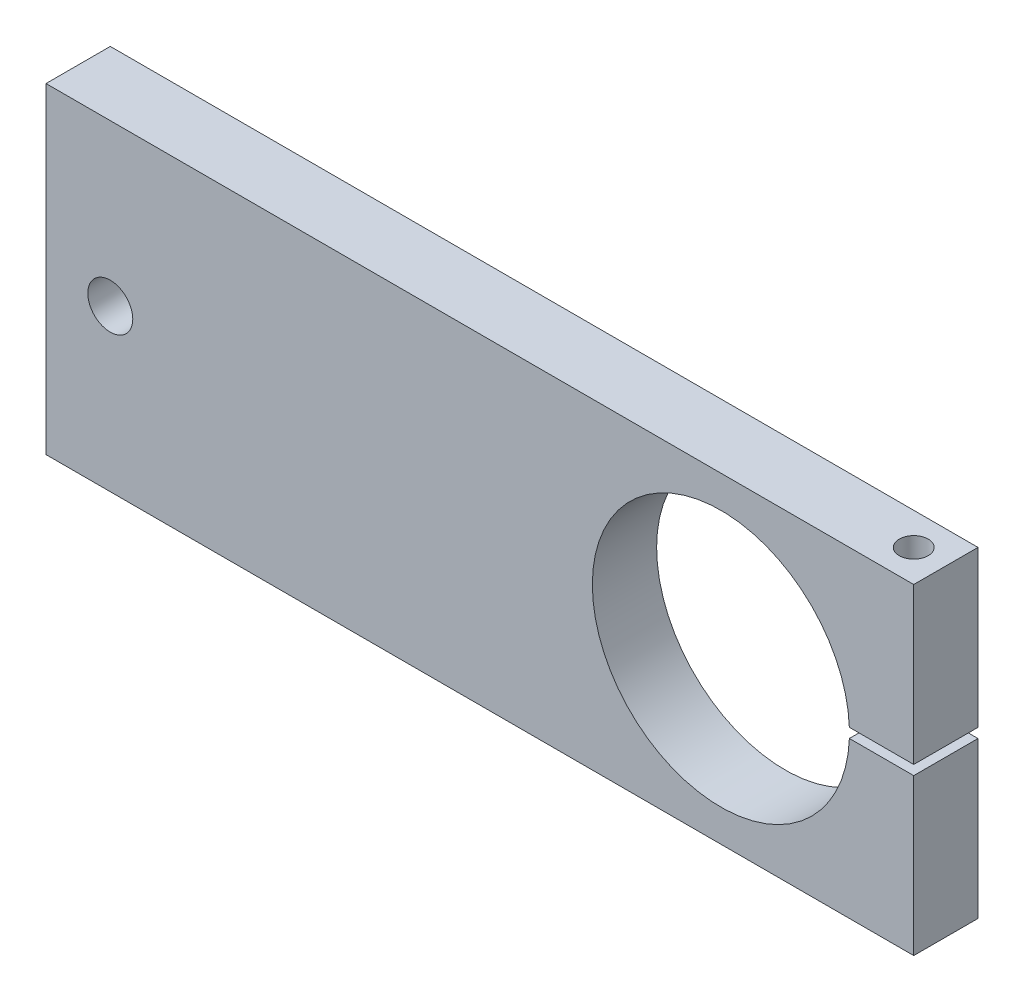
SolidWorks part; units mm, degrees
ref_plane "前视基准面" through (0, 0, 0) normal (0, 0, 1) x (1, 0, 0)
ref_plane "上视基准面" through (0, 0, 0) normal (0, 1, 0) x (1, 0, 0)
ref_plane "右视基准面" through (0, 0, 0) normal (1, 0, 0) x (0, 0, -1)
sketch "草图1" plane through (0, 0, 0) normal (0, 0, 1) x (1, 0, 0)
  line L0 (0, 0) -> (-190, 0) construction
  line L1 (-190, 0) -> (-210, 0) construction
  line L2 (-210, 50) -> (-210, -50)
  line L3 (-210, -50) -> (60, -50)
  line L4 (60, -50) -> (60, -1.5)
  line L5 (60, 50) -> (-210, 50)
  line L6 (60, 1.5) -> (60, 50)
  line L7 (39.9719, 1.5) -> (60, 1.5)
  line L9 (39.9719, -1.5) -> (60, -1.5)
  line L11 (8.0211, 1.5) -> (71.9789, -1.5) construction
  line L12 (8.0211, -1.5) -> (71.9789, 1.5) construction
  arc A0 (39.9719, 1.5) -> (39.9719, -1.5) centre (0, 0) ccw
  circle A1 centre (-190, 0) radius 7
  point P7 (40, 0)
  dimension "D2" = 3
extrude "凸台-拉伸1" add sketch "草图1" along normal blind 20
sketch "草图2" plane through (0, -50, 0) normal (0, -1, 0) x (1, 0, 0)
  line L0 (60, 10) -> (50, 10) construction
  line L1 (60, 20) -> (60, 0) construction
  circle A0 centre (50, 10) radius 7
extrude "切除-拉伸1" cut sketch "草图2" against normal blind 10
sketch "草图3" plane through (0, -40, 0) normal (0, -1, 0) x (1, 0, 0)
  circle A0 centre (50, 10) radius 4.5
extrude "切除-拉伸2" cut sketch "草图3" against normal up to surface (90 mm away)
